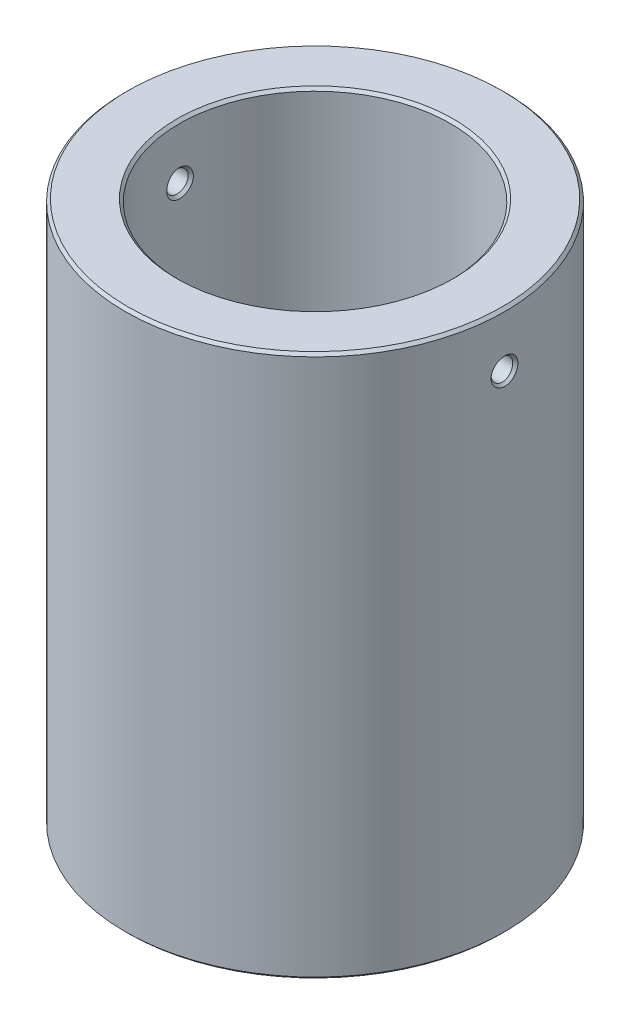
SolidWorks part; units mm, degrees
ref_plane "Спереди" through (0, 0, 0) normal (0, 0, 1) x (1, 0, 0)
ref_plane "Сверху" through (0, 0, 0) normal (0, 1, 0) x (1, 0, 0)
ref_plane "Справа" through (0, 0, 0) normal (1, 0, 0) x (0, 0, -1)
sketch "Эскиз1" plane through (0, 0, 0) normal (0, 1, 0) x (1, 0, 0)
  circle A0 centre (0, 0) radius 25
  circle A1 centre (0, 0) radius 35
  dimension "D1" = 50
  dimension "D2" = 70
extrude "Бобышка-Вытянуть1" add sketch "Эскиз1" along normal mid plane 100
sketch "Эскиз2" plane through (0, 0, 0) normal (1, 0, 0) x (0, 0, -1)
  line L0 (25, 50) -> (-25, 50) construction
  circle A0 centre (0, 40) radius 2
  dimension "D1" = 4
  dimension "D2" = 10
extrude "Вырез-Вытянуть1" cut sketch "Эскиз2" against normal mid plane 70
chamfer "Фаска1" distance 0.5 angle 45 8 edges at (0, -50, 25) (0, 50, 25) (-24.924, 39.5472, 1.9481) (24.924, 40.4528, 1.9481) (0, -50, 35) (0, 50, 35) (-34.997, 41.9472, 0.4563) (34.9458, 40.4563, 1.9472)
